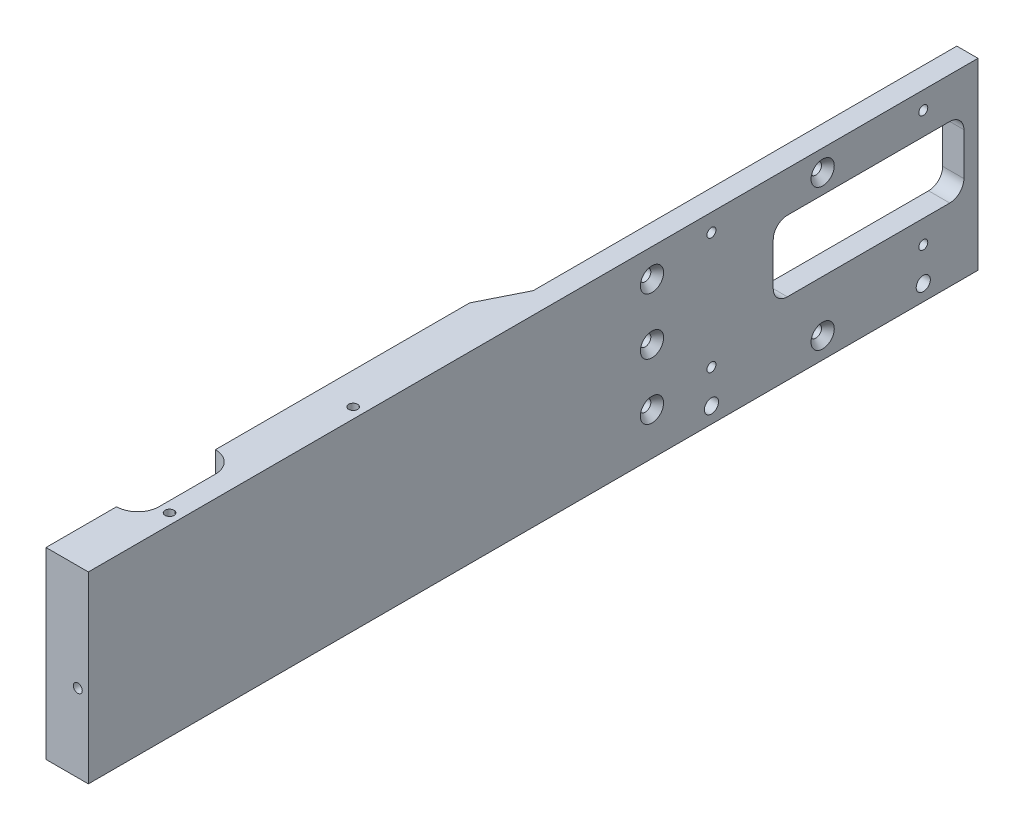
SolidWorks part; units mm, degrees
ref_plane "Front" through (0, 0, 0) normal (0, 0, 1) x (1, 0, 0)
ref_plane "Top" through (0, 0, 0) normal (0, 1, 0) x (1, 0, 0)
ref_plane "Right" through (0, 0, 0) normal (1, 0, 0) x (0, 0, -1)
ref_plane "Plane1" through (91.948, 0, 0) normal (1, 0, 0) x (0, 0, -1)
sketch "Sketch1" plane through (91.948, 0, 0) normal (1, 0, 0) x (0, 0, -1)
  line L1 (190.5, 34.1376) -> (400.05, 34.1376)
  line L2 (190.5, 34.1376) -> (190.5, -48.4188)
  line L3 (190.5, -48.4188) -> (400.05, -48.4188)
  line L4 (400.05, 34.1376) -> (400.05, -48.4188)
  dimension "D1" = 34.1376
  dimension "D2" = 48.4188
  dimension "D3" = 190.5
  dimension "D4" = 209.55
  dimension "D5" = 82.5564
extrude "Extrude1" add sketch "Sketch1" against normal blind 9.525
sketch "Sketch3" plane through (82.423, 0, 0) normal (-1, 0, 0) x (0, 0, 1)
  line L0 (-387.35, -9.525) -> (-314.325, -9.525) construction
  line L1 (-350.8375, -9.525) -> (-350.8375, -15.875) construction
  line L3 (-314.325, -15.875) -> (-387.35, -15.875)
  line L4 (-387.35, 9.525) -> (-314.325, 9.525) construction
  line L5 (-350.8375, 15.875) -> (-350.8375, 9.525) construction
  line L6 (-387.35, 15.875) -> (-314.325, 15.875)
  line L8 (-393.7, 9.525) -> (-393.7, -9.525)
  line L9 (-307.975, 9.525) -> (-307.975, -9.525)
  arc A0 (-307.975, -9.525) -> (-314.325, -15.875) centre (-314.325, -9.525) cw
  arc A1 (-393.7, -9.525) -> (-387.35, -15.875) centre (-387.35, -9.525) ccw
  arc A2 (-314.325, 15.875) -> (-307.975, 9.525) centre (-314.325, 9.525) cw
  arc A3 (-387.35, 15.875) -> (-393.7, 9.525) centre (-387.35, 9.525) ccw
  point P12 (-350.8375, -9.525)
  point P19 (-350.8375, 9.525)
  dimension "D3" = 85.725
  dimension "D6" = 6.35
  dimension "D2" = 9.525
  dimension "D4" = 314.325
  dimension "Slot length" = 85.725
  dimension "D5" = 9.525
extrude "Slot" cut sketch "Sketch3" against normal through all
other "slot straight<1>"
sketch "Sketch7" plane through (0, 0, 0) normal (0, 1, 0) x (1, 0, 0)
  line L0 (82.423, 190.5) -> (82.423, 209.55)
  line L1 (72.898, 190.5) -> (82.423, 209.55)
  line L2 (82.423, 190.5) -> (72.898, 190.5)
  dimension "D1" = 9.525
  dimension "D2" = 19.05
extrude "Extrude2" add sketch "Sketch7" along normal up to surface and the other way up to surface
sketch "Sketch17" plane through (0, 0, -190.5) normal (0, 0, 1) x (1, 0, 0)
  line L0 (91.948, 34.1376) -> (91.948, -48.4188) construction
  line L1 (72.898, 34.1376) -> (91.948, 34.1376)
  line L2 (72.898, 34.1376) -> (72.898, -48.4188)
  line L3 (72.898, -48.4188) -> (91.948, -48.4188)
  line L4 (91.948, 34.1376) -> (91.948, -48.4188)
extrude "Boss-Extrude1" add sketch "Sketch17" along normal blind 190.5
sketch "Sketch14" plane through (82.423, 0, 0) normal (-1, 0, 0) x (0, 0, 1)
  line L1 (0, 34.1376) -> (0, -48.4188) construction
  line L2 (-400.05, 34.1376) -> (0, 34.1376) construction
  line L3 (-400.05, -48.4188) -> (-400.05, 34.1376) construction
  circle A0 centre (-375.4438, 26.2001) radius 2.0193
  circle A1 centre (-375.4438, -26.1874) radius 2.0193
  circle A2 centre (-280.1937, 26.2001) radius 2.0193
  circle A3 centre (-280.1937, -26.1874) radius 2.0193
  dimension "D2" = 95.25
  dimension "D4" = 52.3875
  dimension "D5" = 4.0386
  dimension "D6" = 280.1937
  dimension "D1" = 24.6062
  dimension "D3" = 7.9375
extrude "CTD Holes" cut sketch "Sketch14" against normal through all
hole_wizard "1/4 (0.25) Diameter Hole1" positions "Sketch16" profile "Sketch15" hole size "1/4" standard "Ansi Inch"
sketch "Sketch16" plane through (91.948, 0, 0) normal (1, 0, 0) x (0, 0, -1)
  line L1 (0, 34.1376) -> (0, -48.4188) construction
  point P0 (280.1938, -41.275)
  point P6 (375.4437, -41.275)
  dimension "D1" = 41.275
  dimension "D2" = 280.1938
  dimension "D3" = 95.25
sketch "Sketch15" plane through (91.948, -41.275, -280.1938) normal (0, 1, 0) x (0, 0, -1)
  line L0 (0, 0) -> (0, 19.05)
  line L1 (0, 19.05) -> (3.175, 19.05)
  line L2 (3.175, 19.05) -> (3.175, 0)
  line L5 (3.175, 0) -> (0, 0)
  line L11 (0, -6.35) -> (0, 107.95) construction
  dimension "Thru Hole Dia." = 6.35
  dimension "Thru Hole Depth" = 19.05
hole_wizard "#10-32 Tapped Hole2" positions "Sketch9" profile "Sketch8" tap size "#10-32" standard "Ansi Inch"
sketch "Sketch9" plane through (0, 34.1376, 0) normal (0, 1, 0) x (-1, 0, 0)
  line L0 (-91.948, -400.05) -> (-91.948, 0) construction
  line L3 (-91.948, 0) -> (-72.898, 0) construction
  point P0 (-87.1855, -41.275)
  point P1 (-87.1855, -123.825)
  dimension "D1" = 4.7625
  dimension "D2" = 82.55
  dimension "D3" = 41.275
  dimension "D4" = 41.275
  dimension "D5" = 87.1855
sketch "Sketch8" plane through (87.1855, 34.1376, -41.275) normal (1, 0, 0) x (0, 0, 1)
  line L0 (0, 0) -> (0, 13.9133)
  line L1 (0, 13.9133) -> (2.0193, 12.7)
  line L2 (2.0193, 12.7) -> (2.0193, 0)
  line L5 (2.0193, 0) -> (0, 0)
  line L10 (0, 13.9133) -> (-2.0193, 12.7) construction
  line L11 (0, -6.35) -> (0, 107.95) construction
  dimension "Tap Drill Dia." = 4.0386
  dimension "Tap Drill Depth" = 12.7
  dimension "Drill Angle" = 118
hole_wizard "#10-32 Tapped Hole3" positions "Sketch12" profile "Sketch11" tap size "#10-32" standard "Ansi Inch"
sketch "Sketch12" plane through (-5.3116, 12.7788, 0) normal (0, 0, 1) x (1, 0, 0)
  line L2 (97.2596, 21.3588) -> (78.2096, 21.3588) construction
  line L4 (97.2596, -61.1975) -> (97.2596, 21.3588) construction
  point P0 (92.4971, -26.2662)
  dimension "D1" = 47.625
  dimension "D2" = 4.7625
sketch "Sketch11" plane through (87.1855, -13.4874, 0) normal (1, 0, 0) x (0, -1, 0)
  line L0 (0, 0) -> (0, 23.4383)
  line L1 (0, 23.4383) -> (2.0193, 22.225)
  line L2 (2.0193, 22.225) -> (2.0193, 0)
  line L5 (2.0193, 0) -> (0, 0)
  line L10 (0, 23.4383) -> (-2.0193, 22.225) construction
  line L11 (0, -6.35) -> (0, 107.95) construction
  dimension "Tap Drill Dia." = 4.0386
  dimension "Tap Drill Depth" = 22.225
  dimension "Drill Angle" = 118
sketch "Sketch18" plane through (0, 34.1376, 0) normal (0, -1, 0) x (1, 0, 0)
  line L0 (72.898, 0) -> (72.898, -190.5) construction
  line L1 (82.423, -66.675) -> (82.423, -41.275)
  line L2 (72.898, -31.75) -> (72.898, -76.2)
  line L3 (72.898, 0) -> (91.948, 0) construction
  arc A0 (82.423, -41.275) -> (72.898, -31.75) centre (72.898, -41.275) ccw
  arc A1 (72.898, -76.2) -> (82.423, -66.675) centre (72.898, -66.675) ccw
  dimension "D2" = 25.4
  dimension "D3" = 9.525
  dimension "D1" = 41.275
extrude "Cut-Extrude1" cut sketch "Sketch18" along normal through all
hole_wizard "CSK for #10 Flat Head Socket Cap Screw1" positions "Sketch20" profile "Sketch19" countersink size "#10" standard "Ansi Inch"
sketch "Sketch20" plane through (91.948, 0, 0) normal (1, 0, 0) x (0, 0, -1)
  line L0 (0, -48.4188) -> (0, 34.1376) construction
  line L1 (400.05, 34.1376) -> (0, 34.1376) construction
  line L2 (0, -48.4188) -> (400.05, -48.4188) construction
  point P0 (253.4412, 21.4376)
  point P1 (253.4412, -3.9624)
  point P10 (330.2, -38.8938)
  point P12 (330.2, 24.6126)
  point P19 (253.4412, -29.3624)
  dimension "D1" = 253.4412
  dimension "D2" = 12.7
  dimension "D3" = 25.4
  dimension "D4" = 9.525
  dimension "D5" = 9.525
  dimension "D6" = 330.2
  dimension "D7" = 25.4
sketch "Sketch19" plane through (91.948, 21.4376, -253.4412) normal (0, 1, 0) x (0, 0, -1)
  line L0 (0, 0) -> (0, 19.05)
  line L1 (0, 19.05) -> (2.5527, 19.05)
  line L2 (2.5527, 19.05) -> (2.5527, 3.068)
  line L3 (2.5527, 3.068) -> (5.2197, 0)
  line L5 (5.2197, 0) -> (0, 0)
  line L6 (-2.5527, 3.068) -> (-5.2197, 0) construction
  line L11 (0, -6.35) -> (0, 107.95) construction
  dimension "Thru Hole Dia." = 5.1054
  dimension "Thru Hole Depth" = 19.05
  dimension "Near C'Sink Dia." = 10.4394
  dimension "Near C'Sink Angle" = 82
equation "\"Buoyancy\"=\"SW-Volume\"*(\"SW-Density\"-.037062)"
